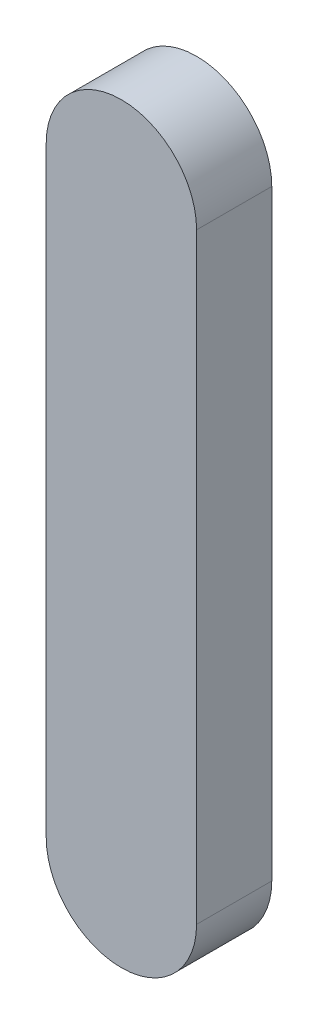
SolidWorks part; units mm, degrees
ref_plane "前视基准面" through (0, 0, 0) normal (0, 0, 1) x (1, 0, 0)
ref_plane "上视基准面" through (0, 0, 0) normal (0, 1, 0) x (1, 0, 0)
ref_plane "右视基准面" through (0, 0, 0) normal (1, 0, 0) x (0, 0, -1)
sketch "草图1" plane through (0, 0, 0) normal (0, 0, 1) x (1, 0, 0)
  line L0 (-1.5, -4) -> (-1.5, -16) construction
  line L1 (1.5, -16) -> (1.5, -4) construction
  line L2 (-1.5, -4) -> (-1.5, -16)
  line L3 (1.5, -16) -> (1.5, -4)
  arc A0 (-1.5, -16) -> (1.5, -16) centre (0, -16) ccw construction
  arc A1 (1.5, -4) -> (-1.5, -4) centre (0, -4) ccw construction
  arc A2 (-1.5, -16) -> (1.5, -16) centre (0, -16) ccw
  arc A3 (1.5, -4) -> (-1.5, -4) centre (0, -4) ccw
extrude "拉伸1" add sketch "草图1" along normal blind 1.5
